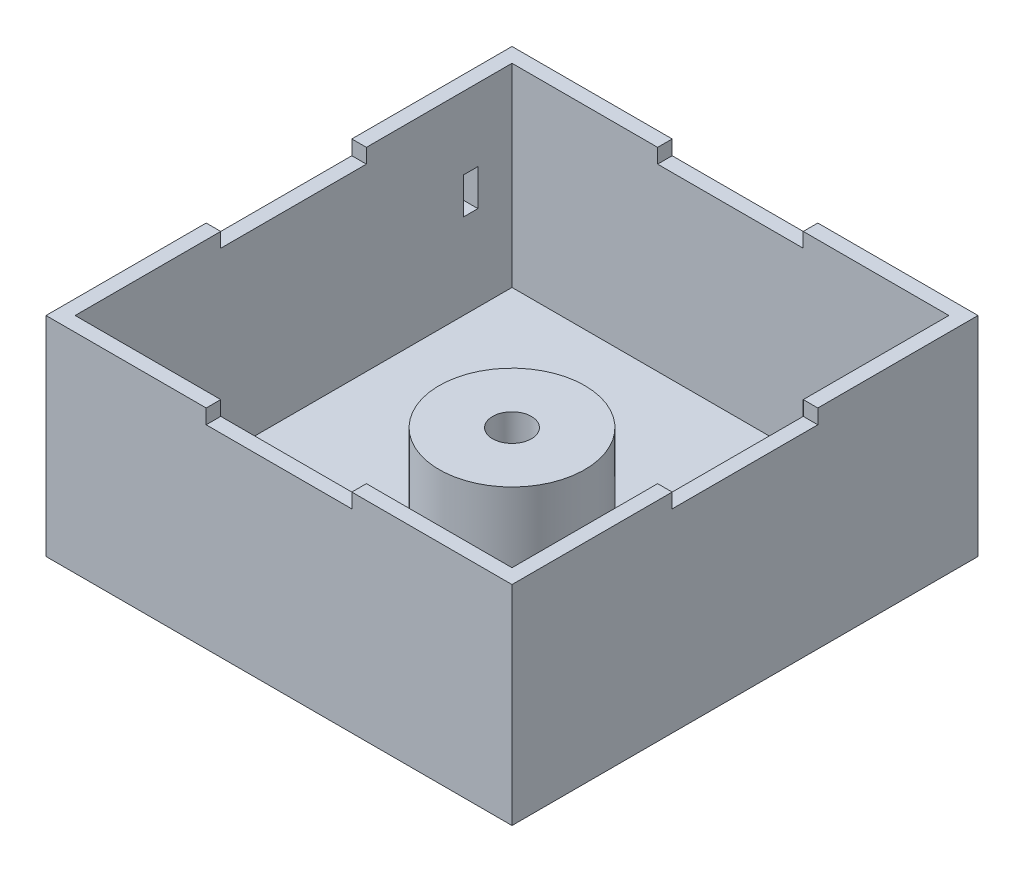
SolidWorks part; units mm, degrees
ref_plane "Front Plane" through (0, 0, 0) normal (0, 0, 1) x (1, 0, 0)
ref_plane "Top Plane" through (0, 0, 0) normal (0, 1, 0) x (1, 0, 0)
ref_plane "Right Plane" through (0, 0, 0) normal (1, 0, 0) x (0, 0, -1)
sketch "Sketch1" plane through (0, 0, 0) normal (0, 1, 0) x (1, 0, 0)
  circle A0 centre (0, 0) radius 4
extrude "Boss-Extrude1" add sketch "Sketch1" along normal blind 140
ref_plane "Plane1" through (0, -20, 0) normal (0, -1, 0) x (-1, 0, 0)
sketch "Sketch9" plane through (0, 0, 0) normal (0, -1, 0) x (1, 0, 0)
  circle A0 centre (0, 0) radius 15
sketch "Sketch2" plane through (0, -20, 0) normal (0, -1, 0) x (-1, 0, 0)
  circle A0 centre (0, 0) radius 15
  dimension "D1" = 30
loft "Loft1" add profiles "Sketch2", "Sketch9"
sketch "Sketch3" plane through (0, -20, 0) normal (0, -1, 0) x (-1, 0, 0)
  line L0 (-48, 48) -> (48, 48)
  line L1 (-45, -45) -> (45, -45)
  line L2 (-45, -45) -> (-45, 45)
  line L3 (-45, 45) -> (45, 45)
  line L4 (45, -45) -> (45, 45)
  line L5 (-45, -45) -> (45, 45) construction
  line L6 (-45, 45) -> (45, -45) construction
  line L7 (48, -48) -> (48, 48)
  line L8 (-48, -48) -> (48, -48)
  line L9 (-48, -48) -> (-48, 48)
  point P0 (0, 0)
extrude "Boss-Extrude2" add sketch "Sketch3" against normal blind 40 separate body
sketch "Sketch4" plane through (0, -20, 0) normal (0, -1, 0) x (-1, 0, 0)
  line L0 (48, -48) -> (48, 48) construction
  line L1 (-48, -48) -> (48, -48) construction
  line L2 (-48, 48) -> (-48, -48) construction
  line L3 (48, 48) -> (-48, 48) construction
  line L4 (48, -48) -> (48, 48)
  line L5 (-48, -48) -> (48, -48)
  line L6 (-48, 48) -> (-48, -48)
  line L7 (48, 48) -> (-48, 48)
extrude "Boss-Extrude3" add sketch "Sketch4" along normal blind 3
sketch "Sketch5" plane through (0, 20, 0) normal (0, 1, 0) x (1, 0, 0)
  line L0 (-48, -48) -> (-48, 48) construction
  line L1 (-48, 15) -> (-45, 15)
  line L2 (-48, 15) -> (-48, -15)
  line L3 (-48, -15) -> (-45, -15)
  line L4 (-45, 15) -> (-45, -15)
  line L5 (-45, -45) -> (-45, 45) construction
  point P8 (-45, 0)
extrude "Cut-Extrude1" cut sketch "Sketch5" against normal blind 3
sketch "Sketch7" plane through (0, 0, 0) normal (0, 0, 1) x (1, 0, 0)
  line L0 (0, 140) -> (0, 0) construction
  line L1 (4, 140) -> (-4, 140) construction
pattern_circular "CirPattern1" count 4 over 360 about axis through (0, 0, 0) along (0, 1, 0) of "Cut-Extrude1"
sketch "Sketch8" plane through (-48, 0, 0) normal (-1, 0, 0) x (0, 0, 1)
  line L1 (-37.9785, 5.0802) -> (-34.9785, 5.0802)
  line L2 (-37.9785, 5.0802) -> (-37.9785, -2.4198)
  line L3 (-37.9785, -2.4198) -> (-34.9785, -2.4198)
  line L4 (-34.9785, 5.0802) -> (-34.9785, -2.4198)
  dimension "D1" = 3
  dimension "D2" = 7.5
extrude "Cut-Extrude2" cut sketch "Sketch8" against normal blind 10
sketch "Sketch10" plane through (0, 140, 0) normal (0, 1, 0) x (1, 0, 0)
  circle A0 centre (0, 0) radius 4 construction
  circle A1 centre (0, 0) radius 4
extrude "Cut-Extrude3" cut sketch "Sketch10" against normal through all both and the other way through all
equation "\"ExternalDiameterBallBearing\" = 22mm"
equation "\"InternalDiameterBallBearing\"= 8mm"
equation "\"HeightJoints\"= 40mm"
equation "\"WidthJoints\"= 3mm"
equation "\"LenghtJoints\"= 7mm"
equation "\"DeepnessJoints\"= 60mm"
equation "\"TurbineShaftDiameter\"= 40mm"
equation "\"HeightTurbine\"= 180mm"
equation "\"HeightBlade\"= 180mm"
equation "\"HeightBallBearing\"= 7mm"
equation "\"D1@Sketch1\"=\"InternalDiameterBallBearing\""
equation "\"D1@Boss-Extrude1\"=\"HeightBase\"+(\"HeightBlade\"+\"HeightJoints\")/2+10mm"
equation "\"HeightBase\"= 20mm"
equation "\"HeightBox\"= 40mm"
equation "\"LenghtBlade\"= 60mm"
equation "\"Lsqare\"= 90mm"
equation "\"D1@Sketch3\"=\"Lsqare\""
equation "\"D2@Sketch3\"=\"Lsqare\""
equation "\"D1@Boss-Extrude2\"=\"HeightBox\""
equation "\"D1@Boss-Extrude3\"=\"WidthJoints\""
equation "\"lenghtJointsForBox\"=30mm"
equation "\"D1@Sketch5\"=\"lenghtJointsForBox\""
equation "\"D1@Cut-Extrude1\"=\"WidthJoints\""
equation "\"D1@Sketch9\"=30mm"
